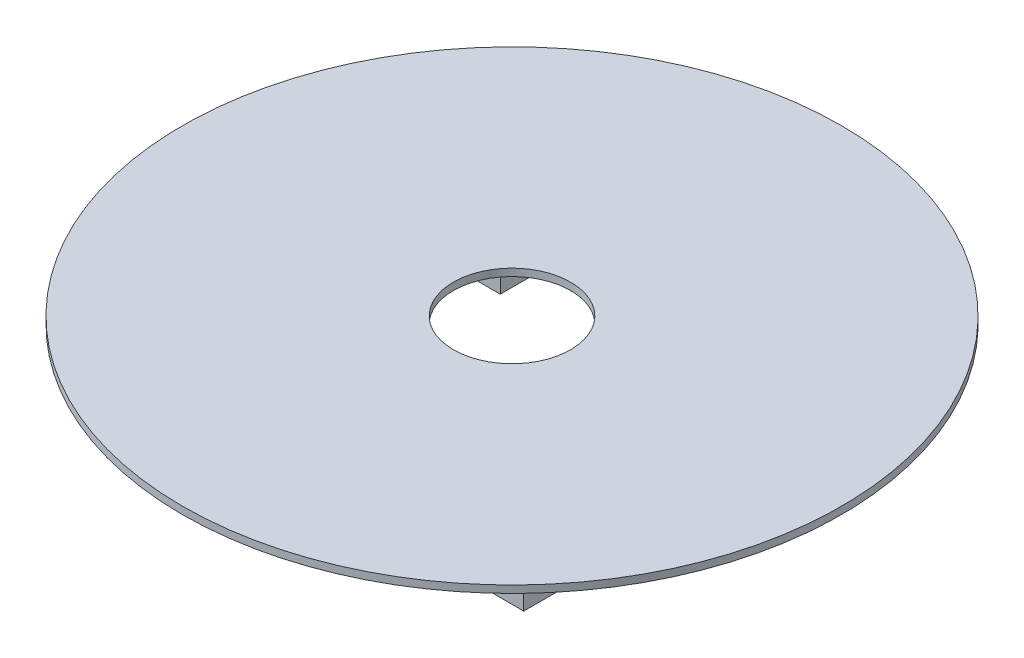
SolidWorks part; units mm, degrees
ref_plane "Front Plane" through (0, 0, 0) normal (0, 0, 1) x (1, 0, 0)
ref_plane "Top Plane" through (0, 0, 0) normal (0, 1, 0) x (1, 0, 0)
ref_plane "Right Plane" through (0, 0, 0) normal (1, 0, 0) x (0, 0, -1)
sketch "Sketch1" plane through (0, 0, 0) normal (0, 1, 0) x (1, 0, 0)
  circle A0 centre (0, 0) radius 4500
  circle A1 centre (0, 0) radius 800
extrude "Boss-Extrude1" add sketch "Sketch1" along normal blind 100
sketch "Sketch2" plane through (0, 0, 0) normal (0, 1, 0) x (1, 0, 0)
  line L1 (627.1068, 627.1068) -> (3120.5592, 627.1068)
  line L2 (627.1068, 627.1068) -> (627.1068, 3120.5592)
  line L3 (627.1068, 3120.5592) -> (3120.5592, 3120.5592)
  line L4 (3120.5592, 627.1068) -> (3120.5592, 3120.5592)
  line L5 (-787.1068, 627.1068) -> (-2960.5592, 627.1068)
  line L6 (-787.1068, 627.1068) -> (-787.1068, 3120.5592)
  line L7 (-787.1068, 3120.5592) -> (-2960.5592, 3120.5592)
  line L8 (-2960.5592, 627.1068) -> (-2960.5592, 3120.5592)
  line L9 (-787.1068, -787.1068) -> (-2960.5592, -787.1068)
  line L10 (-787.1068, -787.1068) -> (-787.1068, -2960.5592)
  line L11 (-787.1068, -2960.5592) -> (-2960.5592, -2960.5592)
  line L12 (-2960.5592, -787.1068) -> (-2960.5592, -2960.5592)
  line L13 (627.1068, -787.1068) -> (3120.5592, -787.1068)
  line L14 (627.1068, -787.1068) -> (627.1068, -2960.5592)
  line L15 (627.1068, -2960.5592) -> (3120.5592, -2960.5592)
  line L16 (3120.5592, -787.1068) -> (3120.5592, -2960.5592)
extrude "Boss-Extrude2" add sketch "Sketch2" against normal blind 350
